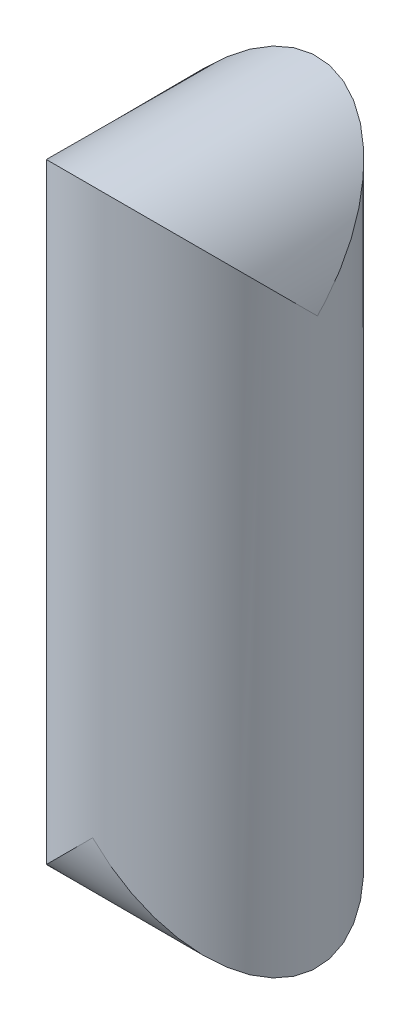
SolidWorks part; units mm, degrees
ref_plane "Front Plane" through (0, 0, 0) normal (0, 0, 1) x (1, 0, 0)
ref_plane "Top Plane" through (0, 0, 0) normal (0, 1, 0) x (1, 0, 0)
ref_plane "Right Plane" through (0, 0, 0) normal (1, 0, 0) x (0, 0, -1)
sketch "Sketch1" plane through (0, 0, 0) normal (0, 1, 0) x (1, 0, 0)
  circle A0 centre (0, 0) radius 30.48
  dimension "D1" = 60.96
extrude "Boss-Extrude1" add sketch "Sketch1" along normal blind 184.15
sketch "Sketch2" plane through (0, 0, 0) normal (0, 0, 1) x (1, 0, 0)
  line L0 (-30.48, 184.15) -> (-30.48, 0) construction
  line L1 (-30.48, 153.6446) -> (-30.48, 184.15)
  line L2 (-30.48, 184.15) -> (30.48, 184.15)
  line L3 (30.48, 184.15) -> (30.48, 153.6446)
  line L9 (-30.48, 153.6446) -> (30.48, 153.6446) construction
  arc A0 (-30.48, 153.6446) -> (30.48, 153.6446) centre (0, 153.6446) cw
  point P3 (0, 184.1246)
  dimension "D1" = 0.0254
extrude "Cut-Extrude1" cut sketch "Sketch2" against normal through all and the other way through all
sketch "Sketch3" plane through (0, 0, 0) normal (1, 0, 0) x (0, 0, -1)
  line L0 (-30.48, 31.0599) -> (-30.48, 0)
  line L1 (-30.48, 184.1246) -> (-30.48, 0) construction
  line L2 (-30.48, 0) -> (30.48, 0)
  line L3 (30.48, 0) -> (30.48, 31.0599)
  line L4 (30.48, 0) -> (30.48, 184.1246) construction
  line L5 (-30.48, 31.0599) -> (30.48, 31.0599) construction
  arc A0 (-30.48, 31.0599) -> (30.48, 31.0599) centre (0, 31.0599) ccw
extrude "Cut-Extrude2" cut sketch "Sketch3" against normal through all and the other way through all
